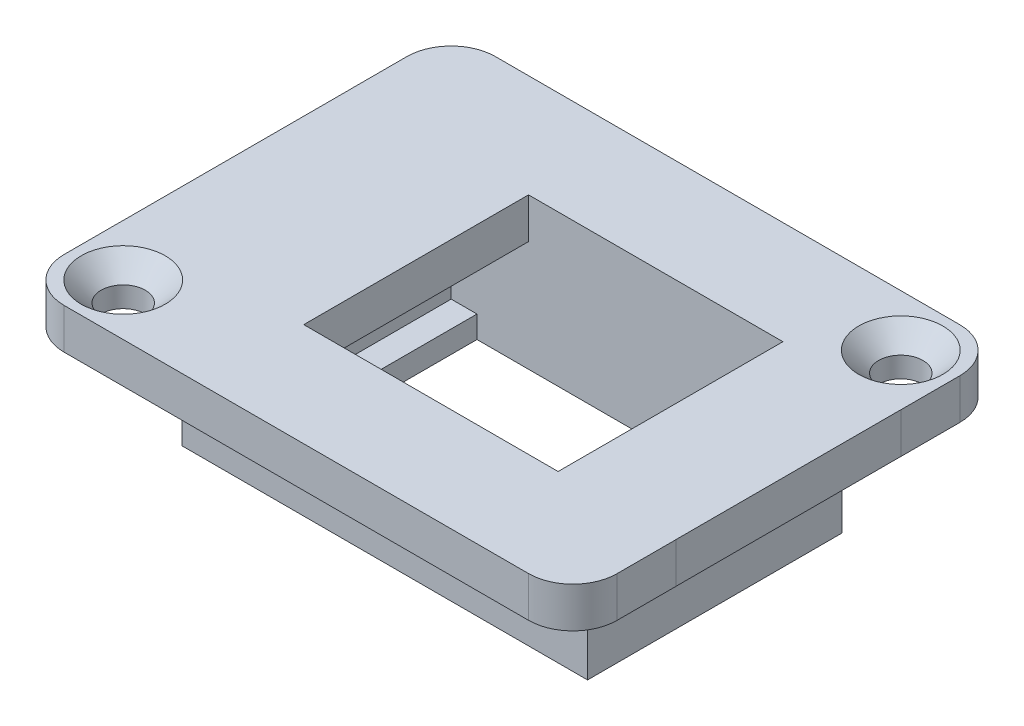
SolidWorks part; units mm, degrees
ref_plane "Front Plane" through (0, 0, 0) normal (0, 0, 1) x (1, 0, 0)
ref_plane "Top Plane" through (0, 0, 0) normal (0, 1, 0) x (1, 0, 0)
ref_plane "Right Plane" through (0, 0, 0) normal (1, 0, 0) x (0, 0, -1)
sketch "Sketch1" plane through (0, 0, 0) normal (0, 0, 1) x (1, 0, 0)
  line L0 (-5.75, 0) -> (10.25, 0) construction
  line L1 (10.25, 0) -> (10.25, -6.5) construction
  line L2 (10.25, -8) -> (11.75, -8) construction
  line L3 (-10.25, -10) -> (-10.25, -13.8781) construction
  line L4 (11.75, -8) -> (10.25, -6.5) construction
  line L5 (10.25, -8) -> (10.25, -9.5)
  line L6 (10.25, -10) -> (-5.75, -10) construction
  line L7 (-8.75, -8) -> (-8.75, -13.8781) construction
  line L8 (-5.75, 0) -> (-5.75, -10) construction
  line L9 (-5.75, 0) -> (-5.75, -8) construction
  line L10 (10.25, 0) -> (10.25, -8) construction
  line L11 (-10.25, -5) -> (-8.75, -8) construction
  line L12 (-10.25, -5) -> (-11.25, -8) construction
  line L13 (-11.75, -8) -> (-10, -8)
  line L14 (-8.75, -5) -> (-8.75, -10) construction
  line L15 (-10.25, -5) -> (-10.25, -10) construction
  line L16 (-8.75, -13.8781) -> (-10.25, -13.8781) construction
  line L19 (10.7534, 0.75) -> (10.7534, -1.9966)
  line L22 (10.25, -8) -> (11.75, -8)
  line L23 (11.75, -8) -> (11.75, -1.9966)
  line L27 (13.75, -1.9966) -> (18.75, -1.9966)
  line L33 (2.25, 0) -> (2.25, -10) construction
  line L47 (-11.75, -8) -> (-11.75, -1.9966)
  line L51 (-13.75, -1.9966) -> (-13.75, -9.5)
  line L53 (-13.75, -1.9966) -> (-18.75, -1.9966)
  line L59 (13.75, -1.9966) -> (13.75, -9.5)
  line L60 (18.75, 0.75) -> (18.75, -1.9966)
  line L61 (-18.75, 0.75) -> (-18.75, -1.9966)
  line L64 (-6.5034, -1.9966) -> (-11.75, -1.9966)
  line L65 (10.7534, -1.9966) -> (11.75, -1.9966)
  line L69 (-10, -9.5) -> (-10, -8)
  line L70 (-13.75, -9.5) -> (-10, -9.5)
  line L71 (-11.75, -9.5) -> (-10, -9.5) construction
  line L72 (10.25, -9.5) -> (13.75, -9.5)
  line L73 (10.25, -9.5) -> (11.75, -9.5) construction
  line L74 (-6.5034, 0.75) -> (-6.5034, -1.9966)
  line L75 (-6.5034, 0.75) -> (-18.75, 0.75)
  line L76 (10.7534, 0.75) -> (18.75, 0.75)
  dimension "D1" = 27.5
  dimension "D2" = 5
  dimension "D3" = 1.5
  dimension "D4" = 16
  dimension "D5" = 1.5
  dimension "D6" = 6.5
  dimension "D7" = 10
  dimension "D8" = 5
extrude "Boss-Extrude1" add sketch "Sketch1" along normal blind 15.25
sketch "Sketch2" plane through (0, 0, 15.25) normal (0, 0, 1) x (1, 0, 0)
  line L2 (18.7534, -1.9966) -> (-18.7534, -1.9966)
  line L4 (-18.7534, -1.9966) -> (-18.7534, 0.75)
  line L5 (18.7534, 0.75) -> (18.7534, -1.9966)
  line L7 (-18.7534, 0.75) -> (18.7534, 0.75)
extrude "Boss-Extrude2" add sketch "Sketch2" along normal blind 7
sketch "Sketch3" plane through (0, 0, 0) normal (0, 0, -1) x (-1, 0, 0)
  line L2 (18.7534, -1.9966) -> (-18.7534, -1.9966)
  line L4 (-18.7534, -1.9966) -> (-18.7534, 0.75)
  line L5 (18.7534, 0.75) -> (18.7534, -1.9966)
  line L7 (-18.7534, 0.75) -> (18.7534, 0.75)
extrude "Boss-Extrude3" add sketch "Sketch3" along normal blind 7
sketch "Sketch9" plane through (0, -1.9966, 0) normal (0, -1, 0) x (1, 0, 0)
  line L0 (18.75, 15.25) -> (18.75, 0) construction
  line L1 (18.7534, -7) -> (-18.7534, -7) construction
  line L2 (-18.75, 15.25) -> (-18.75, 0) construction
  line L3 (-18.7534, 22.25) -> (18.7534, 22.25) construction
  circle A1 centre (-15.25, 18.75) radius 1.5
  circle A5 centre (15.25, -3.5) radius 1.5
  dimension "D1" = 3.5
  dimension "D3" = 3.5
  dimension "D2" = 3.5
  dimension "D4" = 3.5
extrude "Cut-Extrude1" cut sketch "Sketch9" against normal blind 12
fillet "Fillet1" radius 3 4 edges at (18.7534, -0.6233, 22.25) (-18.7534, -0.6233, 22.25) (-18.7534, -0.6233, -7) (18.7534, -0.6233, -7)
sketch "Sketch10" plane through (0, 0.75, 0) normal (0, 1, 0) x (1, 0, 0)
  circle A0 centre (-15.25, -18.75) radius 2.85
  circle A1 centre (15.25, 3.5) radius 2.85
extrude "Cut-Extrude2" cut sketch "Sketch10" against normal blind 6 draft 45
sketch "Sketch11" plane through (0, -1.9966, 0) normal (0, -1, 0) x (1, 0, 0)
  line L0 (-13.75, 15.25) -> (13.75, 15.25)
  line L21 (-13.75, 16.25) -> (13.75, 16.25)
  line L22 (-11.75, 16.25) -> (-6.2534, 16.25) construction
  line L25 (-11.75, 15.25) -> (-6.2534, 15.25) construction
  line L26 (-13.75, 15.25) -> (-13.75, 16.25)
  line L27 (13.75, 15.25) -> (13.75, 16.25)
  line L28 (13.75, 0) -> (13.75, -1)
  line L29 (-13.75, 0) -> (-13.75, -1)
  line L30 (-13.75, -1) -> (13.75, -1)
  line L31 (-13.75, 0) -> (13.75, 0)
extrude "Boss-Extrude5" add sketch "Sketch11" along normal up to vertex (7.5034 mm away) contours L21 L27 L0 L26 | L28 L30 L29 L31
